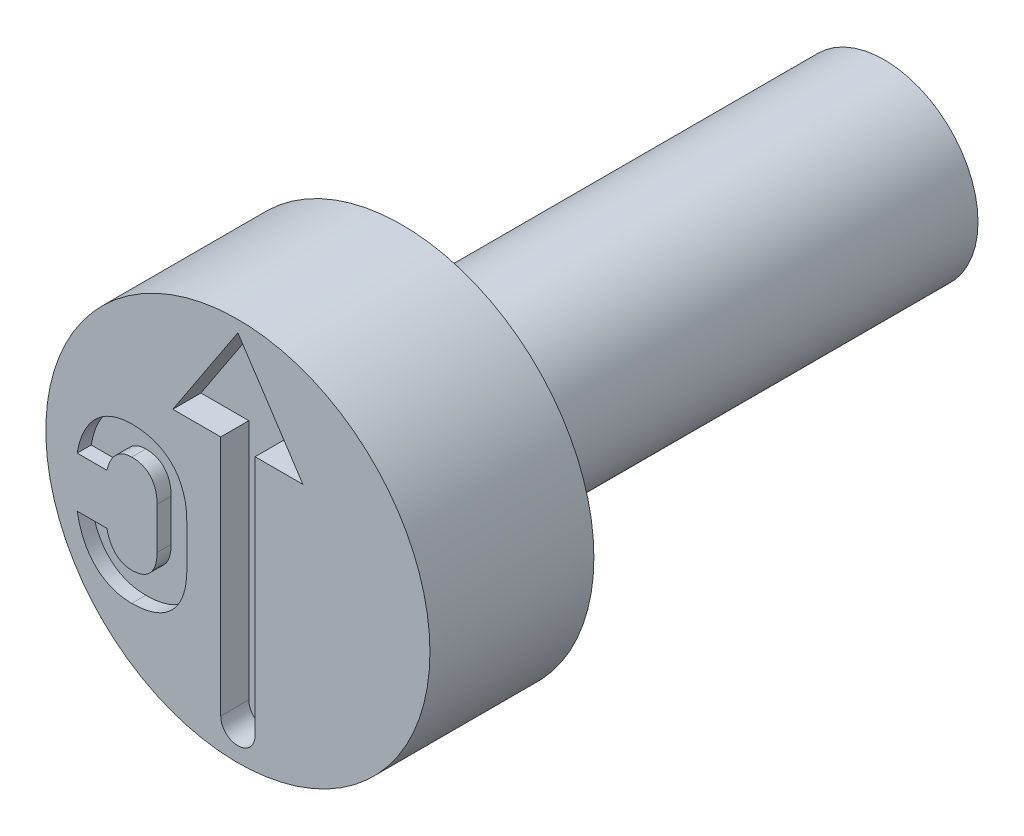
SolidWorks part; units mm, degrees
ref_plane "Front Plane" through (0, 0, 0) normal (0, 0, 1) x (1, 0, 0)
ref_plane "Top Plane" through (0, 0, 0) normal (0, 1, 0) x (1, 0, 0)
ref_plane "Right Plane" through (0, 0, 0) normal (1, 0, 0) x (0, 0, -1)
sketch "Sketch2" plane through (0, 0, 0) normal (1, 0, 0) x (0, 0, -1)
  line L0 (0.4039, 0) -> (50000.4039, 0) construction
  line L6 (0, 4.1) -> (0, 0)
  line L7 (3.5, 4.1) -> (0, 4.1)
  line L8 (3.5, 2) -> (3.5, 4.1)
  line L9 (13.8, 2) -> (3.5, 2)
  line L10 (13.8, 0) -> (13.8, 2)
  line L11 (0, 0) -> (13.8, 0)
  dimension "D1" = 8.2
  dimension "D2" = 4
  dimension "D3" = 13.8
  dimension "D4" = 3.5
revolve "Revolve1" add sketch "Sketch2" angle 360 about L0
sketch "Sketch3" plane through (0, 0, 0) normal (0, 0, 1) x (1, 0, 0)
  line L0 (0, 0) -> (0, 192375) construction
  line L1 (0.3664, 1.7436) -> (0.3664, -3.4169)
  line L2 (1.3888, 1.7436) -> (0.3664, 1.7436)
  line L3 (0, 3.8516) -> (1.3888, 1.7436)
  line L15 (0, 3.8516) -> (-1.3888, 1.7436)
  line L16 (-1.3888, 1.7436) -> (-0.3664, 1.7436)
  line L17 (-0.3664, 1.7436) -> (-0.3664, -3.4169)
  arc A2 (-0.3664, -3.4169) -> (0.3664, -3.4169) centre (0, -3.4169) ccw
extrude "Cut-Extrude4" cut sketch "Sketch3" against normal blind 0.6
sketch "Sketch4" plane through (0, 0, 0) normal (0, 0, 1) x (1, 0, 0)
  text T0 "C" font "Bahnschrift" height 3.25
  dimension "D1" = 2.25
  dimension "D2" = 0.8
extrude "Cut-Extrude5" cut sketch "Sketch4" against normal blind 0.3
